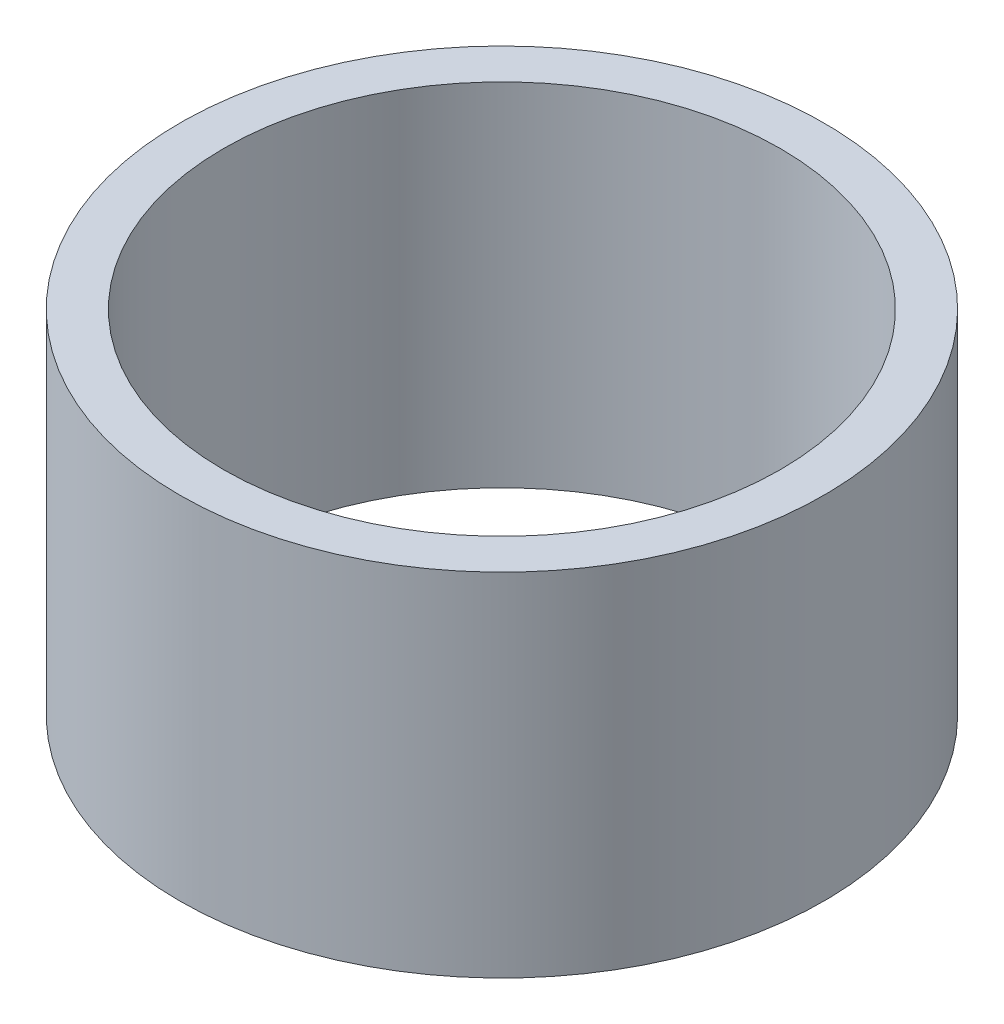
SolidWorks part; units mm, degrees
ref_plane "Front" through (0, 0, 0) normal (0, 0, 1) x (1, 0, 0)
ref_plane "Top" through (0, 0, 0) normal (0, 1, 0) x (1, 0, 0)
ref_plane "Right" through (0, 0, 0) normal (1, 0, 0) x (0, 0, -1)
sketch "Sketch1" plane through (0, 0, 0) normal (0, 1, 0) x (1, 0, 0)
  circle A0 centre (0, 0) radius 11
  circle A1 centre (0, 0) radius 9.5
extrude "Extrude1" add sketch "Sketch1" along normal blind 12
